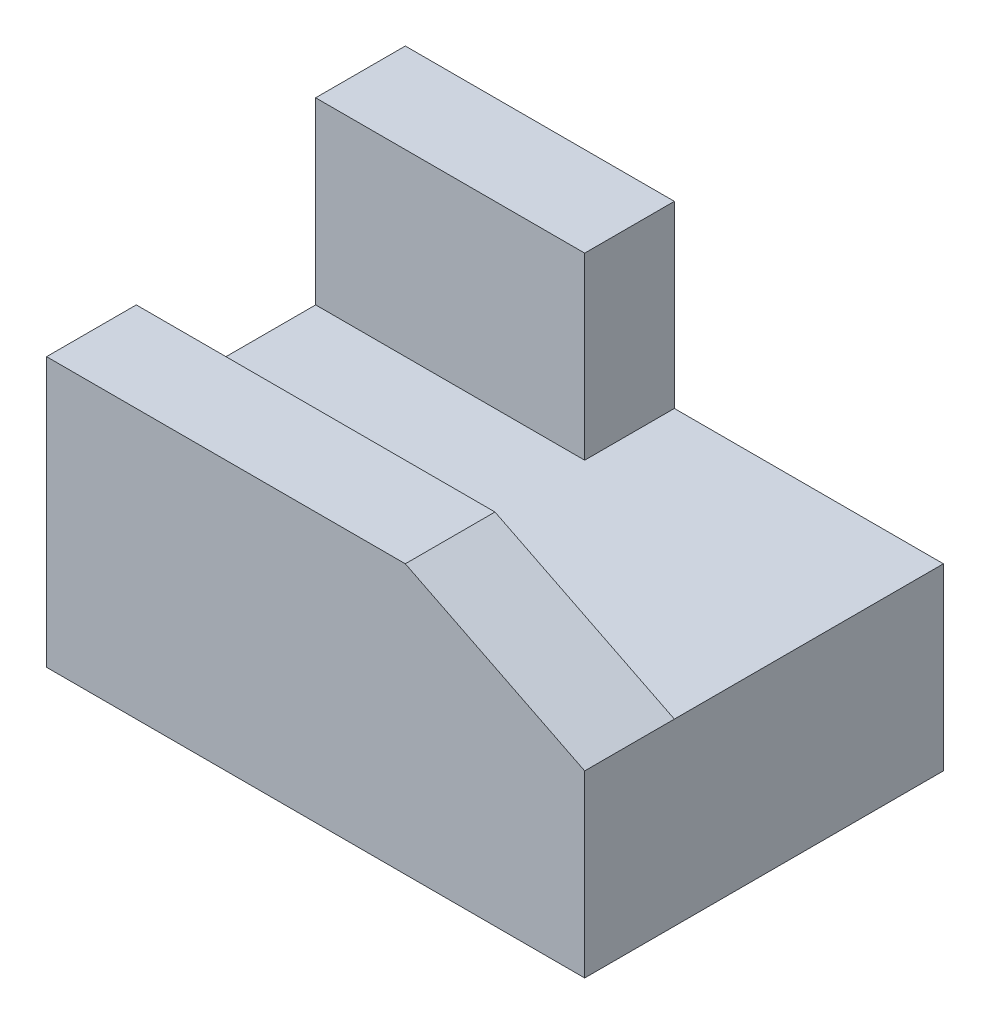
SolidWorks part; units mm, degrees
ref_plane "Front Plane" through (0, 0, 0) normal (0, 0, 1) x (1, 0, 0)
ref_plane "Top Plane" through (0, 0, 0) normal (0, 1, 0) x (1, 0, 0)
ref_plane "Right Plane" through (0, 0, 0) normal (1, 0, 0) x (0, 0, -1)
sketch "Sketch1" plane through (0, 0, 0) normal (0, 1, 0) x (1, 0, 0)
  line L0 (-30, -20) -> (30, 20) construction
  line L1 (-30, -20) -> (30, -20)
  line L2 (-30, -20) -> (-30, 20)
  line L3 (-30, 20) -> (30, 20)
  line L4 (30, -20) -> (30, 20)
  dimension "D1" = 40
  dimension "D2" = 60
extrude "Extrude1" add sketch "Sketch1" along normal blind 20
sketch "Sketch2" plane through (0, 0, 20) normal (0, 0, 1) x (1, 0, 0)
  line L0 (-30, 20) -> (-30, 30)
  line L1 (-30, 30) -> (10, 30)
  line L2 (10, 30) -> (30, 20)
  line L3 (30, 20) -> (-30, 20)
  line L4 (-30, 20) -> (-30, 0) construction
  dimension "D1" = 10
  dimension "D2" = 20
extrude "Extrude2" add sketch "Sketch2" against normal blind 10
sketch "Sketch3" plane through (0, 0, -20) normal (0, 0, -1) x (-1, 0, 0)
  line L1 (30, 20) -> (0, 20)
  line L2 (30, 20) -> (30, 40)
  line L3 (30, 40) -> (0, 40)
  line L4 (0, 20) -> (0, 40)
  dimension "D1" = 30
  dimension "D2" = 20
extrude "Extrude3" add sketch "Sketch3" against normal blind 10
